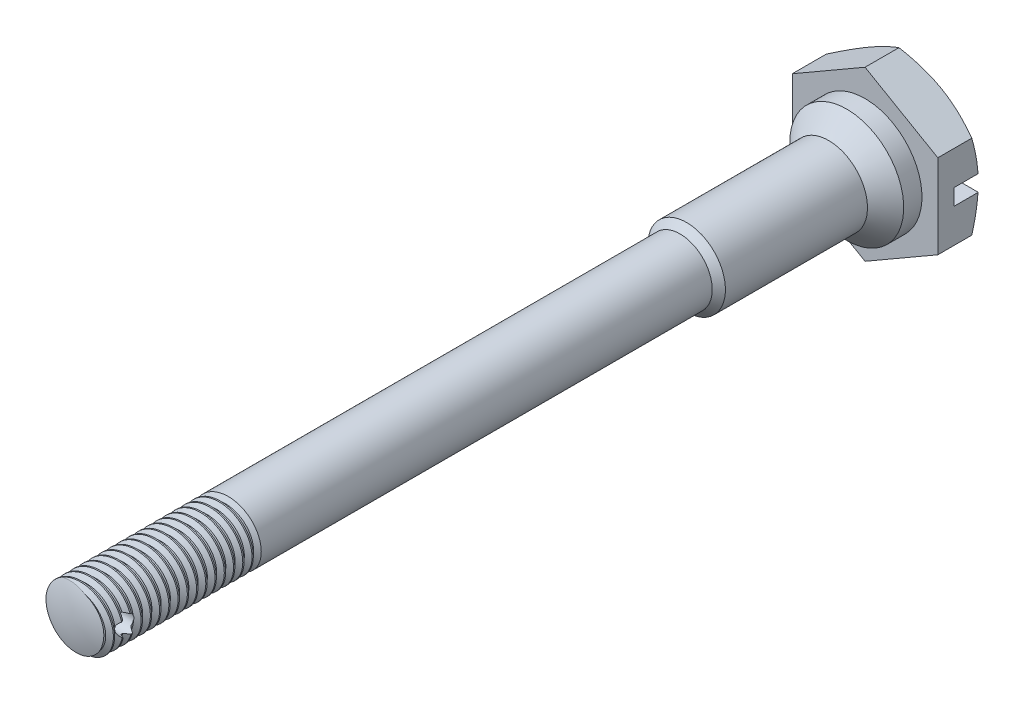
SolidWorks part; units mm, degrees
ref_plane "Спереди" through (0, 0, 0) normal (0, 0, 1) x (1, 0, 0)
ref_plane "Сверху" through (0, 0, 0) normal (0, 1, 0) x (1, 0, 0)
ref_plane "Справа" through (0, 0, 0) normal (1, 0, 0) x (0, 0, -1)
sketch "Эскиз1" plane through (0, 0, 0) normal (1, 0, 0) x (0, 0, -1)
  line L0 (0, 0) -> (-77.7875, 0) construction
  line L1 (-77.7875, 0) -> (0, 0)
  line L2 (0, 0) -> (0, 5.588)
  line L3 (0, 5.588) -> (-1.7939, 5.588)
  line L4 (-1.7939, 5.588) -> (-3.5719, 3.81)
  line L5 (-3.5719, 3.81) -> (-17.5133, 3.81)
  line L6 (-17.5133, 3.81) -> (-18.161, 3.1623)
  line L7 (-18.161, 3.1623) -> (-77.2472, 3.1623)
  arc A0 (-77.2472, 3.1623) -> (-77.7875, 0) centre (-68.2625, 0) ccw
  dimension "D8" = 9.525
  dimension "D1" = 6.3246
  dimension "D2" = 11.176
  dimension "D3" = 7.62
  dimension "D4" = 45
  dimension "D5" = 18.161
  dimension "D6" = 3.5719
  dimension "D7" = 77.7875
revolve "Повернуть1" add sketch "Эскиз1" angle 360 about L0
sketch "Эскиз2" plane through (0, 0, 0) normal (0, 0, -1) x (-1, 0, 0)
  line L1 (0, 8.2489) -> (-7.1438, 4.1244)
  line L2 (-7.1438, 4.1244) -> (-7.1438, -4.1244)
  line L3 (-7.1438, -4.1244) -> (0, -8.2489)
  line L4 (0, -8.2489) -> (7.1437, -4.1244)
  line L5 (7.1437, -4.1244) -> (7.1437, 4.1244)
  line L6 (7.1437, 4.1244) -> (0, 8.2489)
  circle A0 centre (0, 0) radius 7.1438 construction
  dimension "D1" = 14.2875
extrude "Бобышка-Вытянуть1" add sketch "Эскиз2" along normal blind 3.9688
sketch "Эскиз3" plane through (0, 0, 0) normal (1, 0, 0) x (0, 0, -1)
  line L0 (0, 0) -> (9.8572, 0) construction
  line L1 (3.3307, 8.2489) -> (3.9688, 8.2489)
  line L3 (3.9688, 8.2489) -> (3.9688, 7.1437)
  line L4 (3.9688, 7.1437) -> (3.3307, 8.2489)
  dimension "D1" = 30
  dimension "D2" = 7.1437
revolve "Вырез-Повернуть1" cut sketch "Эскиз3" angle 360 about L0
sketch "Эскиз4" plane through (7.1438, 0, 0) normal (1, 0, 0) x (0, 0, -1)
  line L0 (13.5408, 0) -> (-91.4502, 0) construction
  line L1 (3.9688, 0.7937) -> (1.5875, 0.7937)
  line L2 (3.9688, 0.7937) -> (3.9688, -0.7938)
  line L3 (3.9688, -0.7938) -> (1.5875, -0.7938)
  line L4 (1.5875, 0.7937) -> (1.5875, -0.7938)
  line L5 (3.9688, 0) -> (3.9688, 6.1867) construction
  circle A0 centre (-75.4062, 0) radius 0.9271
  dimension "D4" = 1.8542
  dimension "D1" = 1.5875
  dimension "D2" = 2.3813
  dimension "D3" = 75.4062
extrude "Вырез-Вытянуть1" cut sketch "Эскиз4" against normal through all
ref_plane "Плоскость1" through (0, 0, 77.7875) normal (0, 0, 1) x (1, 0, 0)
sketch "Эскиз5" plane through (0, 0, 77.7875) normal (0, 0, 1) x (1, 0, 0)
  circle A0 centre (0, 0) radius 3.175
  dimension "D1" = 6.35
curve "Спираль1"
sketch "Эскиз6" plane through (0, 0, 0) normal (0, 1, 0) x (1, 0, 0)
  line L0 (3.175, -77.7875) -> (3.175, -78.6946) construction
  line L1 (3.175, -78.2411) -> (2.684, -78.2411) construction
  line L2 (3.175, -77.8442) -> (3.175, -78.6379)
  line L3 (3.175, -78.6379) -> (2.684, -78.3545)
  line L4 (2.684, -78.3545) -> (2.684, -78.1277)
  line L5 (2.684, -78.1277) -> (3.175, -77.8442)
  dimension "D1" = 0.9071
  dimension "D2" = 60
  dimension "D3" = 0.0567
  dimension "D4" = 0.2268
sweep "Вырез-По траектории1" cut profiles "Эскиз6" path "Спираль1"
equation "\"D3@Эскиз6\"=\"D1@Эскиз6\"/16"
equation "\"D4@Эскиз6\"=\"D1@Эскиз6\"/4"
